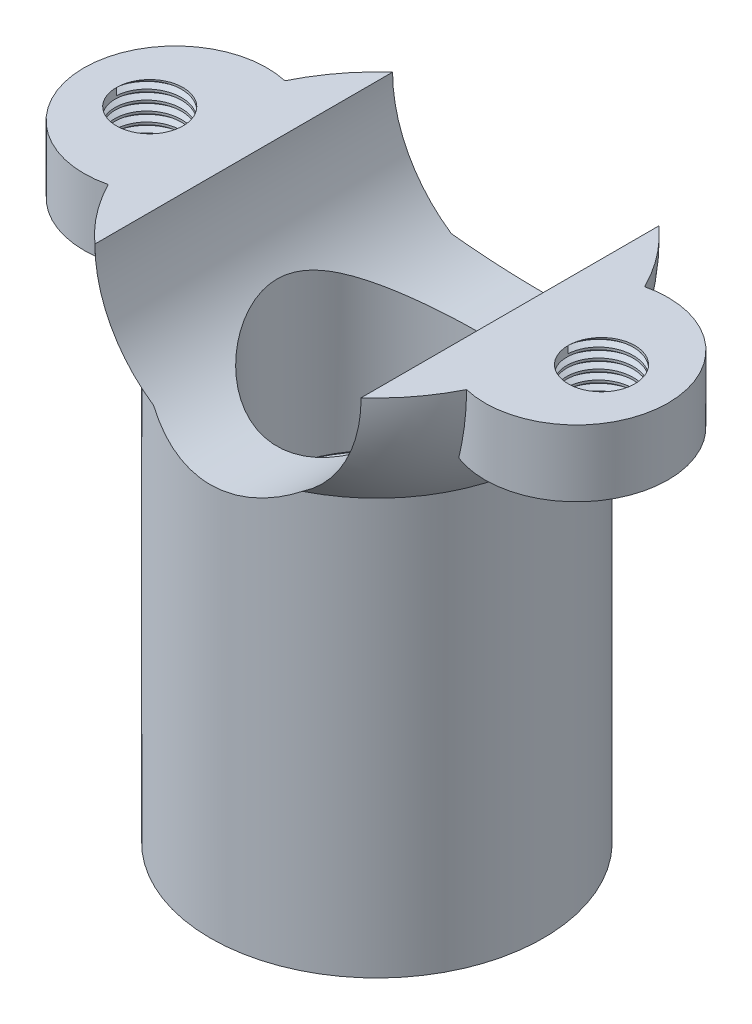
SolidWorks part; units mm, degrees
ref_plane "Front Plane" through (0, 0, 0) normal (0, 0, 1) x (1, 0, 0)
ref_plane "Top Plane" through (0, 0, 0) normal (0, 1, 0) x (1, 0, 0)
ref_plane "Right Plane" through (0, 0, 0) normal (1, 0, 0) x (0, 0, -1)
sketch "Sketch2" plane through (0, 0, 0) normal (0, 0, 1) x (1, 0, 0)
  line L0 (0, 19.05) -> (0, -19.05)
  arc A0 (0, 19.05) -> (0, -19.05) centre (0, 0) cw
  point P4 (0, 0)
  dimension "D1" = 38.1
revolve "Revolve1" add sketch "Sketch2" angle 360 about L0
sketch "Sketch3" plane through (0, 0, 0) normal (0, 1, 0) x (1, 0, 0)
  circle A0 centre (0, 0) radius 15.875
  dimension "D1" = 31.75
extrude "Boss-Extrude1" add sketch "Sketch3" against normal blind 50.165
sketch "Sketch4" plane through (0, 0, 0) normal (0, 0, 1) x (1, 0, 0)
  line L1 (-19.05, 0) -> (19.05, 0)
  line L2 (-19.05, 0) -> (-19.05, 19.05)
  line L3 (-19.05, 19.05) -> (19.05, 19.05)
  line L4 (19.05, 0) -> (19.05, 19.05)
  line L5 (-19.05, 0) -> (19.05, 19.05) construction
  line L6 (-19.05, 19.05) -> (19.05, 0) construction
  arc A0 (15.875, -10.5303) -> (-15.875, -10.5303) centre (0, 0) ccw construction
  point P4 (0, 9.525)
  dimension "D1" = 9.525
extrude "Cut-Extrude1" cut sketch "Sketch4" against normal mid plane 38.1
sketch "Sketch8" plane through (0, 0, 0) normal (0, 1, 0) x (1, 0, 0)
  circle A0 centre (19.05, 0) radius 8.7312
  circle A1 centre (0, 0) radius 19.05 construction
  circle A2 centre (-19.0493, -0.1623) radius 8.7312
  circle A3 centre (0, 0) radius 19.05 construction
  dimension "D1" = 17.4625
  dimension "D2" = 17.4625
  dimension "D3" = 19.0493
extrude "Boss-Extrude3" add sketch "Sketch8" against normal blind 6.35
sketch "Sketch5" plane through (0, 0, 0) normal (0, 0, 1) x (1, 0, 0)
  line L0 (19.05, 0) -> (-19.05, 0) construction
  circle A0 centre (0, 0) radius 12.7
  dimension "D1" = 25.4
extrude "Cut-Extrude2" cut sketch "Sketch5" against normal mid plane 38.1
ref_plane "Plane2" through (0, -50.165, 0) normal (0, -1, 0) x (-1, 0, 0)
sketch "Sketch9" plane through (0, -50.165, 0) normal (0, -1, 0) x (-1, 0, 0)
  circle A0 centre (0, 0) radius 9.525
  dimension "D1" = 19.05
sketch "Sketch12" plane through (0, 0, 0) normal (0, 1, 0) x (1, 0, 0)
  line L0 (-27.7802, -0.2367) -> (-21.4302, -0.2367) construction
  line L1 (27.7812, 0) -> (21.4312, 0) construction
  arc A0 (-17.1209, 8.3533) -> (-16.9761, -8.6438) centre (-19.0493, -0.1623) ccw construction
  arc A1 (17.0491, -8.4989) -> (17.0491, 8.4989) centre (19.05, 0) ccw construction
  circle A2 centre (-21.4302, -0.2367) radius 3.175
  circle A3 centre (21.4312, 0) radius 3.175
  point P16 (21.4312, 0)
  dimension "D1" = 6.35
  dimension "D2" = 6.35
  dimension "D3" = 6.35
extrude "Cut-Extrude3" cut sketch "Sketch9" against normal blind 50.165 contours A0
extrude "Cut-Extrude6" cut sketch "Sketch12" against normal blind 17.78 contours A2 | A3
thread "Thread1" pitch 1.5875 start angle 0, offset 0, length 25.4, pitch 1.5875, diameter 19.05
ref_plane "Plane3" through (9.525, -50.165, 0) normal (0, 0, 1) x (1, 0, 0)
sketch "Thread Profile1" plane through (9.525, -50.165, 0) normal (0, 0, 1) x (1, 0, 0)
  line L0 (0, 0) -> (0, 1.5875) construction
  line L1 (0, 0) -> (0.8593, 0.4961)
  line L2 (0.8593, 0.4961) -> (0.8593, 0.6945)
  line L3 (0.8593, 0.6945) -> (0, 1.1906)
  line L4 (0.8593, 0.5953) -> (0, 0.5953) construction
  line L11 (0, 0) -> (0, 1.1906)
  point P2 (0, 0)
  dimension "Pitch" = 1.5875
  dimension "Profile_Angle" = 60
  dimension "Profile_Land" = 0.1984
  dimension "Profile_Height" = 0.8593
thread "Thread2" pitch 0.9071 start angle 0, offset 0, length 6.35, pitch 0.9071, diameter 6.35
ref_plane "Plane4" through (18.2562, 0, 0) normal (0, 0, 1) x (-1, 0, 0)
sketch "Thread Profile2" plane through (18.2562, 0, 0) normal (0, 0, 1) x (-1, 0, 0)
  line L0 (0, 0) -> (0, 0.9071) construction
  line L1 (0, 0) -> (0.491, 0.2835)
  line L2 (0.491, 0.2835) -> (0.491, 0.3969)
  line L3 (0.491, 0.3969) -> (0, 0.6804)
  line L4 (0.491, 0.3402) -> (0, 0.3402) construction
  line L11 (0, 0) -> (0, 0.6804)
  point P2 (0, 0)
  dimension "Pitch" = 0.9071
  dimension "Profile_Angle" = 60
  dimension "Profile_Land" = 0.1134
  dimension "Profile_Height" = 0.491
thread "Thread3" pitch 0.9071 start angle 0, offset 0, length 6.35, pitch 0.9071, diameter 6.35
ref_plane "Plane6" through (-24.6052, 0, 0.2367) normal (0, 0, 1) x (-1, 0, 0)
sketch "Thread Profile4" plane through (-24.6052, 0, 0.2367) normal (0, 0, 1) x (-1, 0, 0)
  line L0 (0, 0) -> (0, 0.9071) construction
  line L1 (0, 0) -> (0.491, 0.2835)
  line L2 (0.491, 0.2835) -> (0.491, 0.3969)
  line L3 (0.491, 0.3969) -> (0, 0.6804)
  line L4 (0.491, 0.3402) -> (0, 0.3402) construction
  line L11 (0, 0) -> (0, 0.6804)
  point P2 (0, 0)
  dimension "Pitch" = 0.9071
  dimension "Profile_Angle" = 60
  dimension "Profile_Land" = 0.1134
  dimension "Profile_Height" = 0.491
